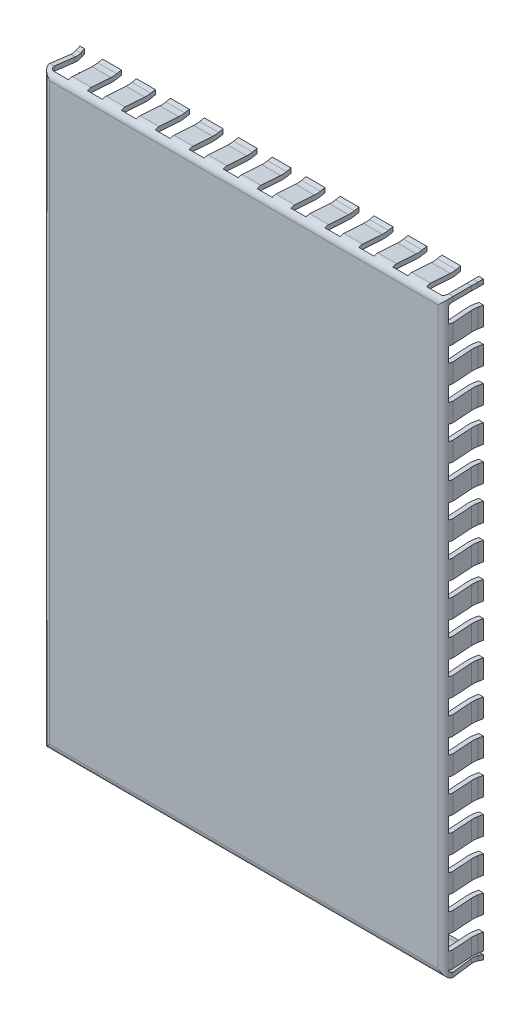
SolidWorks part; units mm, degrees
ref_plane "Face" through (0, 0, 0) normal (0, 0, 1) x (1, 0, 0)
ref_plane "Dessus" through (0, 0, 0) normal (0, 1, 0) x (1, 0, 0)
ref_plane "Droite" through (0, 0, 0) normal (1, 0, 0) x (0, 0, -1)
sketch "Esquisse1" plane through (0, 0, 0) normal (0, 0, 1) x (1, 0, 0)
  line L1 (0, 0) -> (53.5, 0)
  line L2 (0, 0) -> (0, 78.2)
  line L3 (0, 78.2) -> (53.5, 78.2)
  line L4 (53.5, 0) -> (53.5, 78.2)
  dimension "D1" = 53.5
  dimension "D2" = 78.2
extrude "Extrusion1" add sketch "Esquisse1" along normal blind 5
sketch "Esquisse2" plane through (0, 0, 0) normal (0, 0, -1) x (-1, 0, 0)
  line L0 (-53.5, 78.2) -> (0, 78.2) construction
  line L1 (-52.5, 77.2) -> (-1, 77.2)
  line L2 (-52.5, 77.2) -> (-52.5, 1)
  line L3 (-52.5, 1) -> (-1, 1)
  line L4 (-1, 77.2) -> (-1, 1)
  line L5 (-53.5, 0) -> (-53.5, 78.2) construction
  line L6 (0, 78.2) -> (0, 0) construction
  line L7 (0, 0) -> (-53.5, 0) construction
  dimension "D1" = 1
  dimension "D2" = 1
  dimension "D3" = 1
  dimension "D4" = 1
extrude "Enlèv. mat.-Extru.1" cut sketch "Esquisse2" against normal blind 4.5
fillet "Congé1" radius 1
sketch "Esquisse4" plane through (0, 78.2, 0) normal (0, 1, 0) x (-1, 0, 0)
  line L0 (0, 0) -> (-0.1219, 0.6095)
  line L3 (-0.1735, 1.3974) -> (0, 4)
  line L4 (0, 4) -> (0, 0) construction
  line L5 (0, 4) -> (0, 0)
  arc A0 (-0.1219, 0.6095) -> (-0.1735, 1.3974) centre (2.8198, 1.1978) cw
  point P10 (-0.2, 1)
  dimension "D3" = 3
  dimension "D1" = 3
  dimension "D2" = 0.2
extrude "Enlèv. mat.-Extru.2" cut sketch "Esquisse4" against normal through all
ref_plane "Plan1" through (26.75, 0, 0) normal (1, 0, 0) x (0, 0, -1)
mirror "Symétrie1" about plane through (26.75, 0, 0) normal (1, 0, 0)
sketch "Esquisse5" plane through (0, 0, 0) normal (1, 0, 0) x (0, 0, -1)
  line L0 (0, 78.2) -> (-0.6095, 78.0781)
  line L1 (-1.3974, 78.0265) -> (-4, 78.2)
  line L2 (-0.6095, 78.2) -> (-1.3974, 78.2) construction
  line L3 (-4, 78.2) -> (-1.3974, 78.2) construction
  line L4 (-4, 78.2) -> (0, 78.2)
  arc A0 (-0.6095, 78.0781) -> (-1.3974, 78.0265) centre (-1.1978, 81.0198) cw
  point P10 (-1, 78)
  dimension "D3" = 3
  dimension "D1" = 0.2
  dimension "D2" = 3
extrude "Enlèv. mat.-Extru.4" cut sketch "Esquisse5" along normal through all
ref_plane "Plan2" through (0, 39.1, 0) normal (0, 1, 0) x (-1, 0, 0)
mirror "Symétrie2" about plane through (0, 39.1, 0) normal (0, 1, 0)
sketch "Esquisse7" plane through (0, 0, 0) normal (1, 0, 0) x (0, 0, -1)
  line L4 (0.1177, 0.5883) -> (-0.4918, 0.7102)
  line L5 (-1.4373, 0.7722) -> (-4.0399, 0.5987)
  line L6 (0, 0.6119) -> (-0.4918, 0.7102)
  line L7 (-1.4373, 0.7722) -> (-4, 0.6013)
  line L8 (0, 78.2) -> (0, 0) construction
  line L9 (-4, 0) -> (-4, 78.2) construction
  line L10 (-4.5, 1) -> (0, 1) construction
  line L11 (-4.5, 1) -> (0, 1)
  line L12 (0, 1) -> (0, 0.6119)
  arc A2 (-0.4918, 0.7102) -> (-1.4373, 0.7722) centre (-1.1978, -2.8198) ccw
  arc A3 (-0.4918, 0.7102) -> (-1.4373, 0.7722) centre (-1.1978, -2.8198) ccw
  arc A5 (-4, 0.6013) -> (-4.5, 1) centre (-4.0316, 1.0746) cw
  dimension "D1" = 0.6
extrude "Enlèv. mat.-Extru.6" cut sketch "Esquisse7" along normal through all
mirror "Symétrie3" about plane through (0, 39.1, 0) normal (0, 1, 0)
sketch "Esquisse8" plane through (0, 0, 0) normal (0, 1, 0) x (1, 0, 0)
  line L2 (0, 0) -> (53.5, 0) construction
  line L3 (0.6119, 0) -> (0, 0)
  line L4 (0.5883, 0.1177) -> (0.7102, -0.4918)
  line L5 (0.7722, -1.4373) -> (0.5987, -4.0399)
  line L6 (0.6119, 0) -> (0.7102, -0.4918)
  line L7 (0.7722, -1.4373) -> (0.6013, -4)
  line L8 (53.5, -4) -> (0, -4) construction
  line L9 (1, -4.5) -> (1, 0) construction
  line L10 (1, -4.5) -> (1, 0)
  arc A1 (0.6013, -4) -> (1, -4.5) centre (1.0746, -4.0316) ccw
  arc A2 (0.7722, -1.4373) -> (0.7102, -0.4918) centre (-2.8198, -1.1978) ccw
  arc A3 (0.7722, -1.4373) -> (0.7102, -0.4918) centre (-2.8198, -1.1978) ccw
  dimension "D1" = 0.6
extrude "Enlèv. mat.-Extru.7" cut sketch "Esquisse8" against normal through all and the other way through all
mirror "Symétrie4" about plane through (26.75, 0, 0) normal (1, 0, 0)
sketch "Esquisse9" plane through (0, 0, 0) normal (0, 1, 0) x (1, 0, 0)
  line L0 (1, 0) -> (52.5, 0) construction
  line L1 (1, -4.5) -> (3, -4.5)
  line L2 (1, -4.5) -> (1, 0)
  line L3 (1, 0) -> (3, 0)
  line L4 (3, -4.5) -> (3, 0)
  dimension "D1" = 2
extrude "Enlèv. mat.-Extru.8" cut sketch "Esquisse9" along normal through all
pattern_linear "Répétition linéaire1" count 12 spacing 4.5
sketch "Esquisse10" plane through (0, 0, 0) normal (1, 0, 0) x (0, 0, -1)
  line L0 (0, 77.2) -> (0, 1) construction
  line L1 (-4.5, 77.2) -> (0, 77.2)
  line L2 (-4.5, 77.2) -> (-4.5, 75.2)
  line L3 (-4.5, 75.2) -> (0, 75.2)
  line L4 (0, 77.2) -> (0, 75.2)
  dimension "D1" = 2
extrude "Enlèv. mat.-Extru.10" cut sketch "Esquisse10" along normal through all
pattern_linear "Répétition linéaire2" count 17 spacing 4.5
